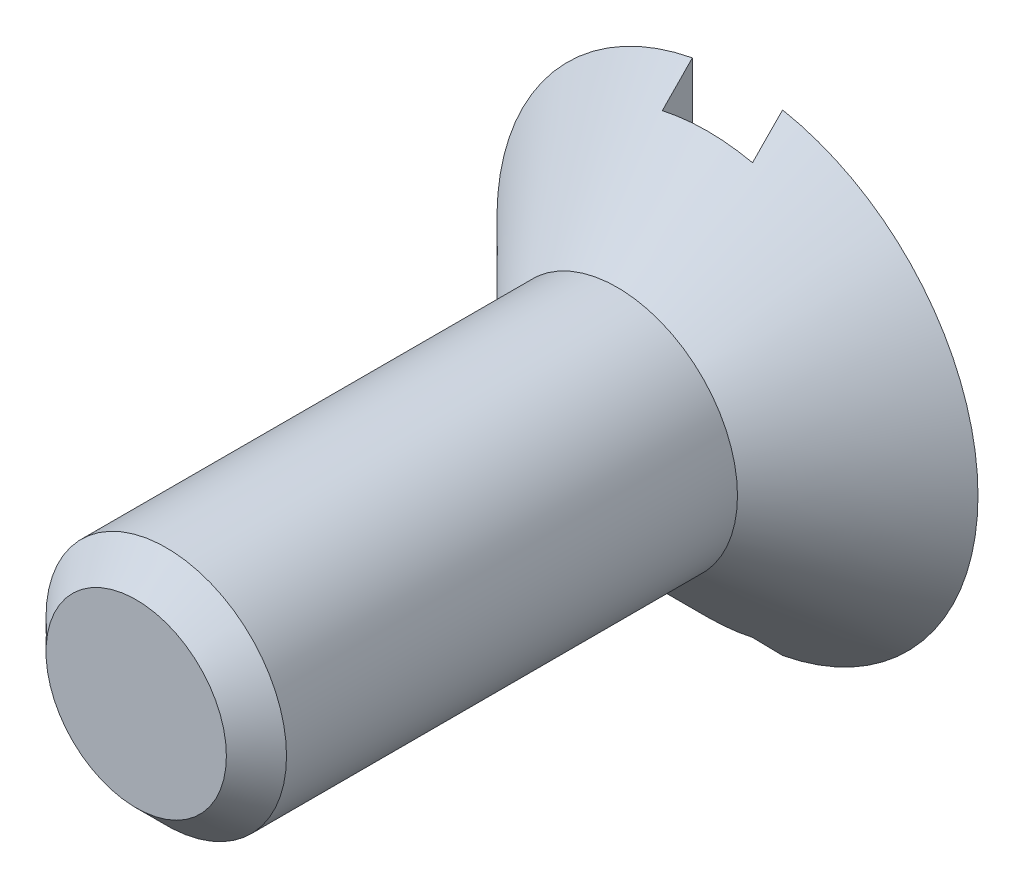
SolidWorks part; units mm, degrees
ref_plane "Plan de face" through (0, 0, 0) normal (0, 0, 1) x (1, 0, 0)
ref_plane "Plan de dessus" through (0, 0, 0) normal (0, 1, 0) x (1, 0, 0)
ref_plane "Plan de droite" through (0, 0, 0) normal (1, 0, 0) x (0, 0, -1)
sketch "Esquisse1" plane through (0, 0, 0) normal (0, 0, 1) x (1, 0, 0)
  circle A1 centre (0, 0) radius 4
  dimension "D2" = 8
extrude "Boss.-Extru.1" add sketch "Esquisse1" along normal blind 2
sketch "Esquisse2" plane through (0, 0, 2) normal (0, 0, 1) x (1, 0, 0)
  circle A0 centre (0, 0) radius 2
  dimension "D1" = 4
chamfer "Chanfrein2" distance 2 angle 45 1 edges at (4, 0, 2)
sketch "Esquisse3" plane through (0, 0, 0) normal (0, 0, -1) x (-1, 0, 0)
  line L1 (-0.75, 5) -> (0.75, 5)
  line L2 (-0.75, 5) -> (-0.75, -5)
  line L3 (-0.75, -5) -> (0.75, -5)
  line L4 (0.75, 5) -> (0.75, -5)
  dimension "D1" = 1.5
  dimension "D2" = 0.75
  dimension "D3" = 5
  dimension "D4" = 10
extrude "Enlèv. mat.-Extru.1" cut sketch "Esquisse3" against normal blind 0.5
extrude "Boss.-Extru.2" add sketch "Esquisse2" along normal blind 8
chamfer "Chanfrein3" distance 0.5 angle 45 1 edges at (2, 0, 10)
